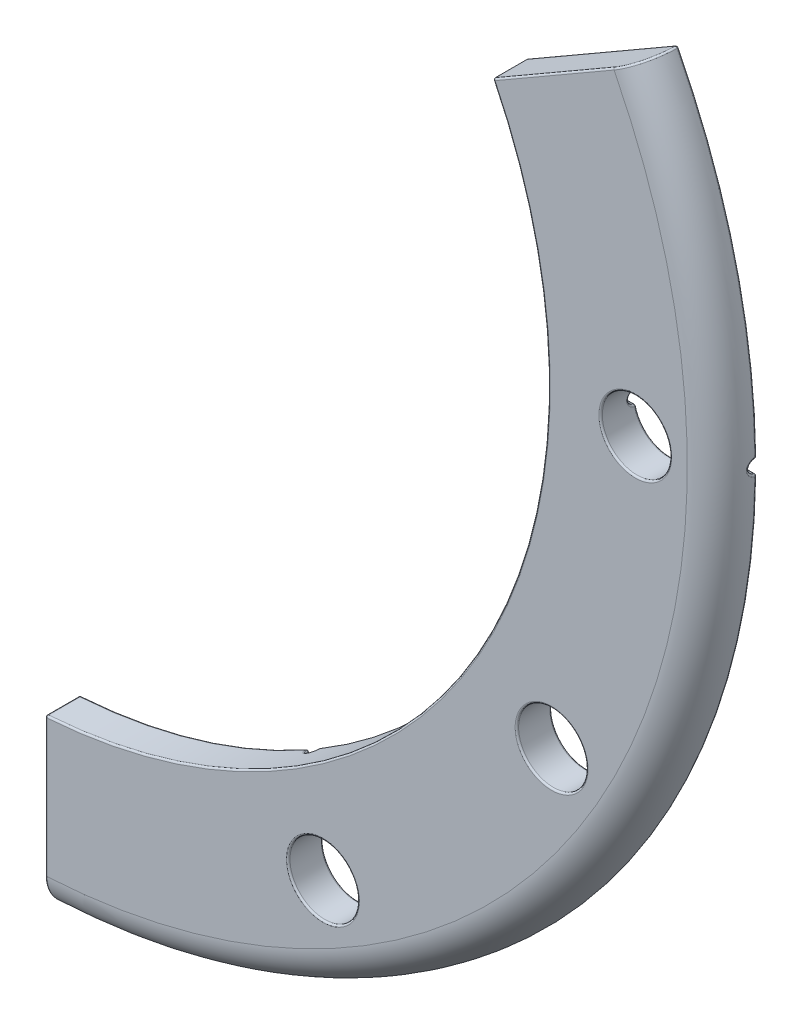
SolidWorks part; units mm, degrees
ref_plane "Спереди" through (0, 0, 0) normal (0, 0, 1) x (1, 0, 0)
ref_plane "Сверху" through (0, 0, 0) normal (0, 1, 0) x (1, 0, 0)
ref_plane "Справа" through (0, 0, 0) normal (1, 0, 0) x (0, 0, -1)
sketch "Эскиз1" plane through (0, 0, 0) normal (0, 0, 1) x (1, 0, 0)
  line L0 (0, 0) -> (0, -205) construction
  line L1 (0, 0) -> (177.5352, 102.5) construction
  line L2 (102.5, -177.5352) -> (0, 0) construction
  line L3 (0, 0) -> (177.5352, -102.5) construction
  line L4 (0, 0) -> (205, 0) construction
  line L5 (10, -204.756) -> (10, -154.6771)
  line L6 (182.3239, 93.7177) -> (138.9543, 68.6783)
  arc A0 (10, -204.756) -> (182.3239, 93.7177) centre (0, 0) ccw
  arc A1 (10, -154.6771) -> (138.9543, 68.6783) centre (0, 0) ccw
  arc A2 (10, -179.722) -> (160.6438, 81.2007) centre (0, 0) ccw construction
  circle A3 centre (0, 0) radius 155 construction
  circle A4 centre (0, 0) radius 180 construction
  circle A5 centre (0, 0) radius 205 construction
  circle A6 centre (180, 0) radius 10
  circle A7 centre (155.8846, -90) radius 10
  circle A8 centre (90, -155.8846) radius 10
  dimension "D1" = 410
  dimension "D9" = 20
  dimension "D4" = 120
  dimension "D5" = 30
  dimension "D6" = 30
  dimension "D7" = 20
  dimension "D8" = 20
  dimension "D2" = 50
  dimension "D3" = 25
extrude "Бобышка-Вытянуть1" add sketch "Эскиз1" along normal blind 10
fillet "Скругление1" radius 10 1 edges at (177.5352, -102.5, 10)
fillet "Скругление2" radius 0.5 17 edges at (134.2339, -77.5, 10) (134.2339, -77.5, 0) (10, -154.6771, 5) (10, -174.7103, 10) (10, -202.5666, 6.2413) (10, -179.7165, 0) (100, -155.8846, 0) (100, -155.8846, 10) (165.8846, -90, 0) (165.8846, -90, 10) (190, 0, 0) (190, 0, 10) (138.9543, 68.6783, 5) (160.6391, 81.198, 0) (179.0748, 91.8419, 7.8039) (156.3035, 78.6949, 10) (177.5352, -102.5, 0)
sketch "Эскиз2" plane through (0, 0, 0) normal (1, 0, 0) x (0, 0, -1)
  circle A0 centre (0, 0) radius 2
  dimension "D1" = 4
extrude "Вырез-Вытянуть1" cut sketch "Эскиз2" along normal through all
ref_plane "Плоскость1" through (0, 0, 0) normal (-0.5, 0.866, 0) x (-0.866, -0.5, 0)
sketch "Эскиз3" plane through (0, 0, 0) normal (-0.5, 0.866, 0) x (-0.866, -0.5, 0)
  circle A0 centre (0, 0) radius 2
  dimension "D1" = 4
extrude "Вырез-Вытянуть2" cut sketch "Эскиз3" against normal through all
fillet "Скругление3" radius 0.5 32 edges at (93.2395, -165.4819, 0.1644) (96.6698, -163.4591, 0.2102) (83.3302, -148.31, 0.2102) (86.7605, -146.2872, 0.1644) (104.131, -176.3677, 0.122) (102.2487, -177.4487, 1.9924) (100.7205, -178.4306, 0.2117) (95.0546, -164.5131, 1.999) (79.2702, -133.3187, 0.1931) (84.9454, -147.2561, 1.999) (75.8413, -135.351, 0.1421) (77.4457, -134.2653, 1.999) (79.5628, -141.8068, 0) (83.0269, -139.8068, 0) (100.4283, -169.9468, 0) (96.9642, -171.9468, 0) (169.9979, -1.9975, 0.1003) (190.0021, 1.9975, 0.1003) (170.1053, 1.9889, 0.2102) (189.8947, -1.9889, 0.2102) (162.5897, 2, 0) (162.5897, -2, 0) (155, 0.0627, 1.999) (197.3924, -2, 0) (197.3924, 2, 0) (204.8044, -1.9963, 0.122) (204.7992, -0.1597, 1.9936) (204.8857, 1.9888, 0.2117) (189.9998, -0.0631, 1.999) (155.1852, 1.9974, 0.1014) (155.0925, -1.9907, 0.1931) (170.0002, 0.0631, 1.999)
